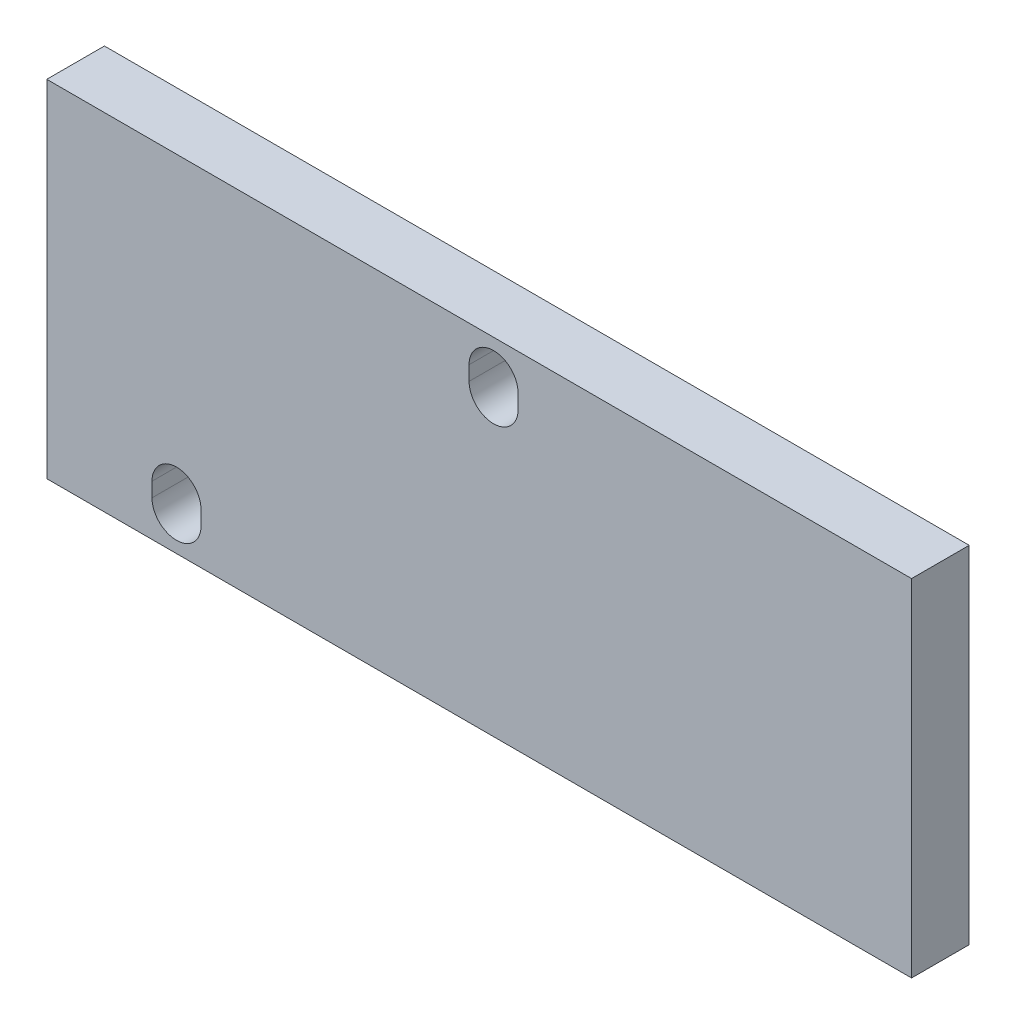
SolidWorks part; units mm, degrees
ref_plane "Plan de face" through (0, 0, 0) normal (0, 0, 1) x (1, 0, 0)
ref_plane "Plan de dessus" through (0, 0, 0) normal (0, 1, 0) x (1, 0, 0)
ref_plane "Plan de droite" through (0, 0, 0) normal (1, 0, 0) x (0, 0, -1)
sketch "Esquisse1" plane through (0, 0, 0) normal (1, 0, 0) x (0, 0, -1)
  line L1 (0, 0) -> (10, 0)
  line L2 (0, 0) -> (0, 60)
  line L3 (0, 60) -> (10, 60)
  line L4 (10, 0) -> (10, 60)
  dimension "D1" = 60
  dimension "D2" = 10
extrude "Extrusion1" add sketch "Esquisse1" along normal blind 150
sketch "Esquisse2" plane through (0, 0, 0) normal (0, 0, 1) x (1, 0, 0)
  line L0 (22.5, 6.25) -> (22.5, 8.75) construction
  line L1 (26.75, 6.25) -> (26.75, 8.75)
  line L2 (77.5, 51.25) -> (77.5, 53.75) construction
  line L3 (18.25, 6.25) -> (18.25, 8.75)
  line L4 (81.75, 51.25) -> (81.75, 53.75)
  line L5 (73.25, 51.25) -> (73.25, 53.75)
  line L6 (0, 60) -> (0, 0) construction
  line L7 (150, 0) -> (0, 0) construction
  arc A0 (26.75, 6.25) -> (18.25, 6.25) centre (22.5, 6.25) cw
  arc A1 (26.75, 8.75) -> (18.25, 8.75) centre (22.5, 8.75) ccw
  arc A2 (81.75, 51.25) -> (73.25, 51.25) centre (77.5, 51.25) cw
  arc A3 (81.75, 53.75) -> (73.25, 53.75) centre (77.5, 53.75) ccw
  point P14 (22.5, 7.5)
  dimension "D5" = 22.5
  dimension "D6" = 55
  dimension "D7" = 2.5
  dimension "D8" = 2.5
  dimension "D9" = 7.5
  dimension "D10" = 45
  dimension "D1" = 4.25
  dimension "D2" = 4.25
  dimension "D3" = 4.25
  dimension "D4" = 4.25
extrude "Enlèv. mat.-Extru.1" cut sketch "Esquisse2" against normal through all
